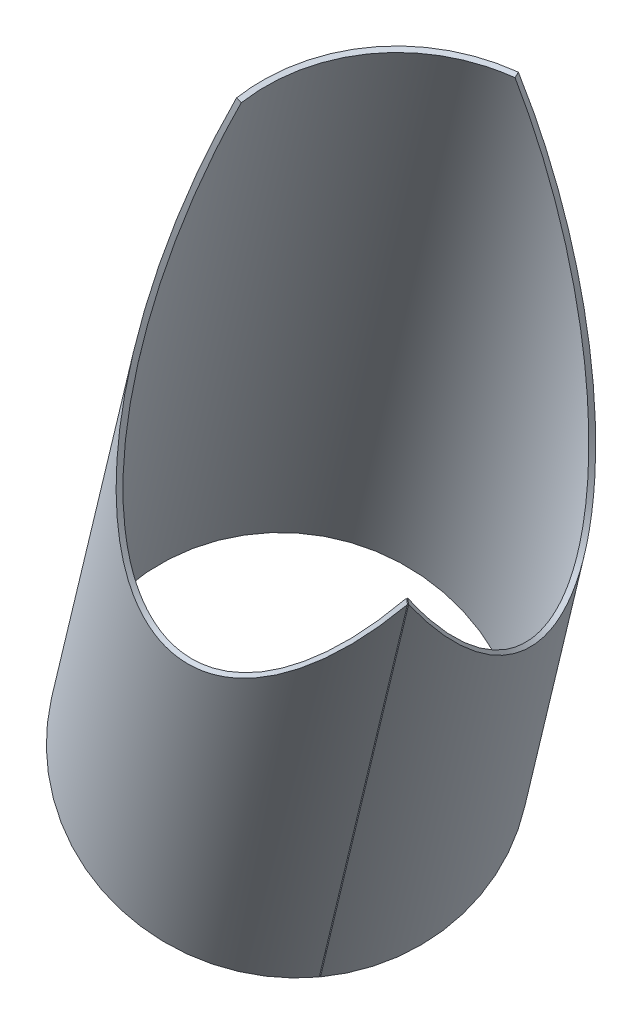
SolidWorks part; units mm, degrees
ref_plane "前视基准面" through (0, 0, 0) normal (0, 0, 1) x (1, 0, 0)
ref_plane "上视基准面" through (0, 0, 0) normal (0, 1, 0) x (1, 0, 0)
ref_plane "右视基准面" through (0, 0, 0) normal (1, 0, 0) x (0, 0, -1)
imported_body "基体零件-等径Y形五通管-1"
sheet metal parameters "钣金1" parameters "D1"=0.7366, "厚度"=6
bend "圆角折弯1" bend radius 204 bend angle 359.727 parameters "D5"=1
flatten bends "展开-折弯1"
sketch "尖角-草图1" plane through (-197.5163, -748.5111, -144.122) normal (0.6756, -0.5528, 0.4879) x (0.3776, -0.309, -0.8729)
  line L0 (430.2037, 647.7588) -> (758.5632, -171.0222) construction
  dimension "D1" = 0
process bends "加工-折弯1" parameters "D1"=0
sketch "平面-草图1" plane through (-197.5163, -748.5111, -144.122) normal (0.6756, -0.5528, 0.4879) x (0.3776, -0.309, -0.8729)
